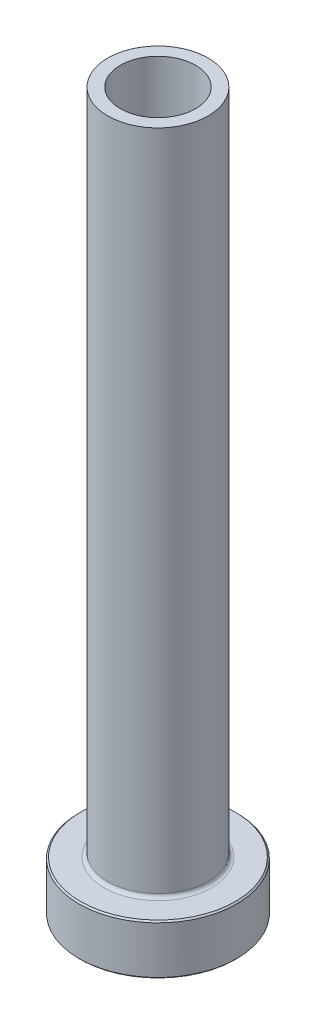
SolidWorks part; units mm, degrees
ref_plane "Front Plane" through (0, 0, 0) normal (0, 0, 1) x (1, 0, 0)
ref_plane "Top Plane" through (0, 0, 0) normal (0, 1, 0) x (1, 0, 0)
ref_plane "Right Plane" through (0, 0, 0) normal (1, 0, 0) x (0, 0, -1)
sketch "Sketch1" plane through (0, 0, 0) normal (0, 0, 1) x (1, 0, 0)
  line L0 (-5.25, 100) -> (-7, 100)
  line L1 (-7, 100) -> (-7, 7)
  line L2 (-7, 7) -> (-11, 7)
  line L3 (-11, 7) -> (-11, 0)
  line L4 (12.1, 0) -> (-12.1, 0) construction
  line L5 (-11, 0) -> (-5.5, 0)
  line L6 (-5.25, 45) -> (-5.25, 100)
  line L7 (0, 92.1877) -> (0, -15.5353) construction
  line L8 (0, -12.1) -> (0, 12.1) construction
  line L9 (-5.25, 45) -> (-5.5, 33)
  line L10 (-5.5, 33) -> (-5.5, 0)
  dimension "D1" = 0.25
  dimension "ID" = 10.5
  dimension "OD" = 14
  dimension "L" = 100
  dimension "H" = 22
  dimension "T" = 7
  dimension "N" = 55
  dimension "D2" = 12
revolve "Revolve1" add sketch "Sketch1" angle 360 about L7
fillet "Fillet1" radius 0.5 1 edges at (0, 7, 7)
chamfer "Chamfer1" distance 0.2 angle 45 2 edges at (0, 7, 11) (0, 0, 11)
chamfer "Chamfer3" distance 0.5 angle 45 1 edges at (0, 0, 5.5)
